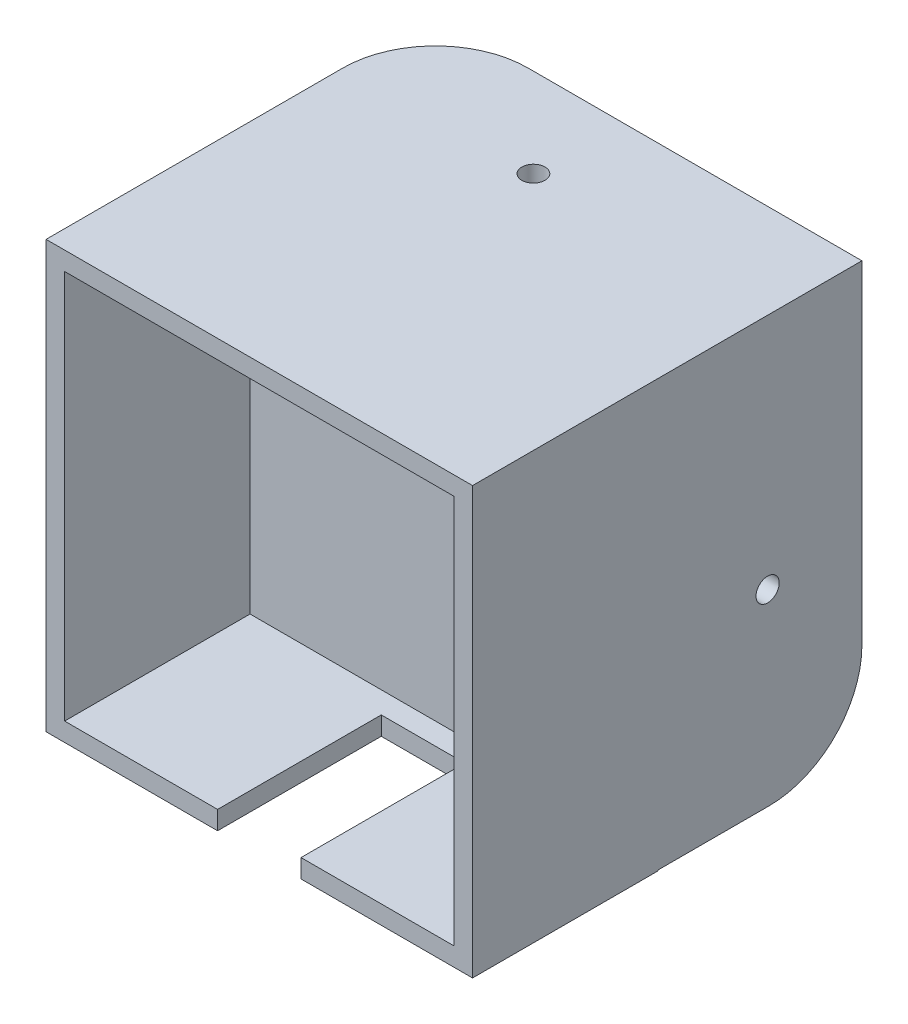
SolidWorks part; units mm, degrees
ref_plane "Front Plane" through (0, 0, 0) normal (0, 0, 1) x (1, 0, 0)
ref_plane "Top Plane" through (0, 0, 0) normal (0, 1, 0) x (1, 0, 0)
ref_plane "Right Plane" through (0, 0, 0) normal (1, 0, 0) x (0, 0, -1)
sketch "Sketch1" plane through (0, 0, 0) normal (0, 0, 1) x (1, 0, 0)
  line L0 (-23, 23) -> (-23, -23)
  line L1 (-21, 21) -> (21, 21)
  line L2 (-21, 21) -> (-21, -21)
  line L3 (-21, -21) -> (21, -21)
  line L4 (21, 21) -> (21, -21)
  line L5 (-23, -23) -> (23, -23)
  line L6 (23, 23) -> (23, -23)
  line L7 (-23, 23) -> (23, 23)
  point P4 (0, 21)
  point P6 (-21, 0)
  dimension "D1" = 42
  dimension "D2" = 42
  dimension "D3" = 2
extrude "Boss-Extrude1" add sketch "Sketch1" along normal blind 20
sketch "Sketch2" plane through (0, 0, 0) normal (0, 0, -1) x (-1, 0, 0)
  line L0 (23, 23) -> (23, -23) construction
  line L1 (-23, 23) -> (23, 23)
  line L2 (-23, 23) -> (-23, -22.9159)
  line L3 (-23, -22.9159) -> (23, -22.9159)
  line L4 (23, 23) -> (23, -22.9159)
  point P5 (23, 23)
extrude "Boss-Extrude2" add sketch "Sketch2" along normal blind 2
sketch "Sketch9" plane through (0, -23, 0) normal (0, -1, 0) x (1, 0, 0)
  line L1 (-4.5, 39.1871) -> (4.5, 39.1871)
  line L2 (-4.5, 39.1871) -> (-4.5, 2.3464)
  line L3 (-4.5, 2.3464) -> (4.5, 2.3464)
  line L4 (4.5, 39.1871) -> (4.5, 2.3464)
  point P4 (0, 2.3464)
  dimension "D1" = 9
extrude "Cut-Extrude3" cut sketch "Sketch9" against normal blind 20
sketch "Sketch17" plane through (23, 0, 0) normal (1, 0, 0) x (0, 0, -1)
  line L0 (-20, 23) -> (2, 23) construction
  line L1 (2, -22.9159) -> (22, -22.9159)
  line L2 (2, -22.9159) -> (2, 23)
  line L3 (2, 23) -> (22, 23)
  line L4 (22, -22.9159) -> (22, 23)
  dimension "D1" = 20
extrude "Boss-Extrude7" add sketch "Sketch17" against normal blind 5
sketch "Sketch18" plane through (0, 23, 0) normal (0, 1, 0) x (1, 0, 0)
  line L1 (23, 22) -> (-23, 22)
  line L2 (23, 22) -> (23, 2)
  line L3 (23, 2) -> (-23, 2)
  line L4 (-23, 22) -> (-23, 2)
extrude "Boss-Extrude8" add sketch "Sketch18" against normal blind 5
sketch "Sketch19" plane through (18, 0, 0) normal (-1, 0, 0) x (0, 0, 1)
  circle A0 centre (-11.8284, -2.6251) radius 1.25
  point P2 (0, 0)
  point P4 (0, 0)
  point P5 (0, 0)
  point P6 (-11.8284, -2.6251)
  point P8 (0, 0)
  dimension "D1" = 2.5
extrude "Cut-Extrude5" cut sketch "Sketch19" against normal blind 5
sketch "Sketch20" plane through (0, 18, 0) normal (0, -1, 0) x (-1, 0, 0)
  circle A0 centre (2.8528, 12.4184) radius 1.25
  dimension "D1" = 2.5
extrude "Cut-Extrude6" cut sketch "Sketch20" against normal blind 5
fillet "Fillet1" radius 10 2 edges at (-23, 20.5, -22) (20.5, -22.9159, -22)
sketch "Sketch16" plane through (21, 0, 0) normal (-1, 0, 0) x (0, 0, 1)
  circle A0 centre (81.3697, -11.2259) radius 1.25
  circle A1 centre (81.3697, 14.1174) radius 1.25
  circle A2 centre (-11.4987, -11.2259) radius 1.25
  circle A3 centre (-13.5539, 16.1009) radius 1.25
  dimension "D1" = 2.5
